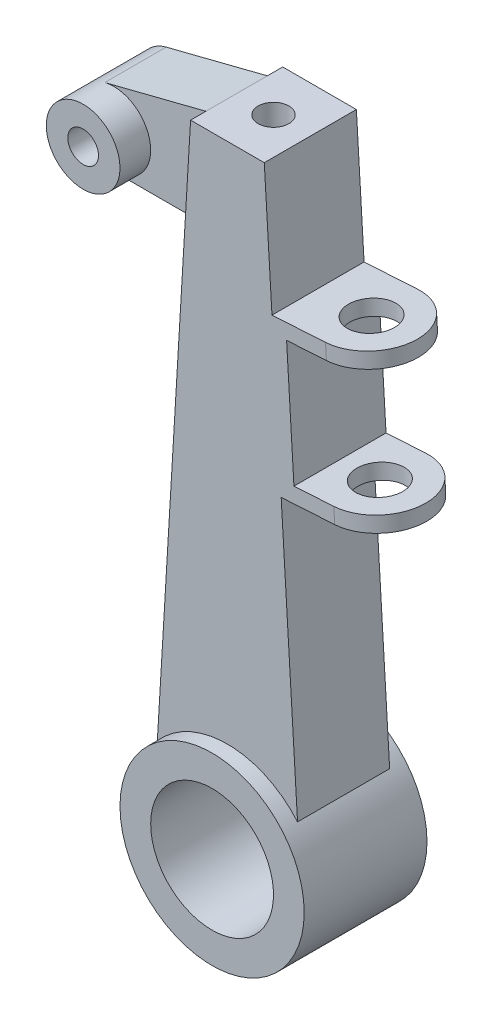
SolidWorks part; units mm, degrees
ref_plane "Plane1" through (0, 0, 0) normal (0, 0, 1) x (1, 0, 0)
ref_plane "Plane2" through (0, 0, 0) normal (0, 1, 0) x (1, 0, 0)
ref_plane "Plane3" through (0, 0, 0) normal (1, 0, 0) x (0, 0, -1)
imported_body "Imported1"
move or copy body "Body-Move/Copy1" bodies to move or copy 101 placed by mates yes
